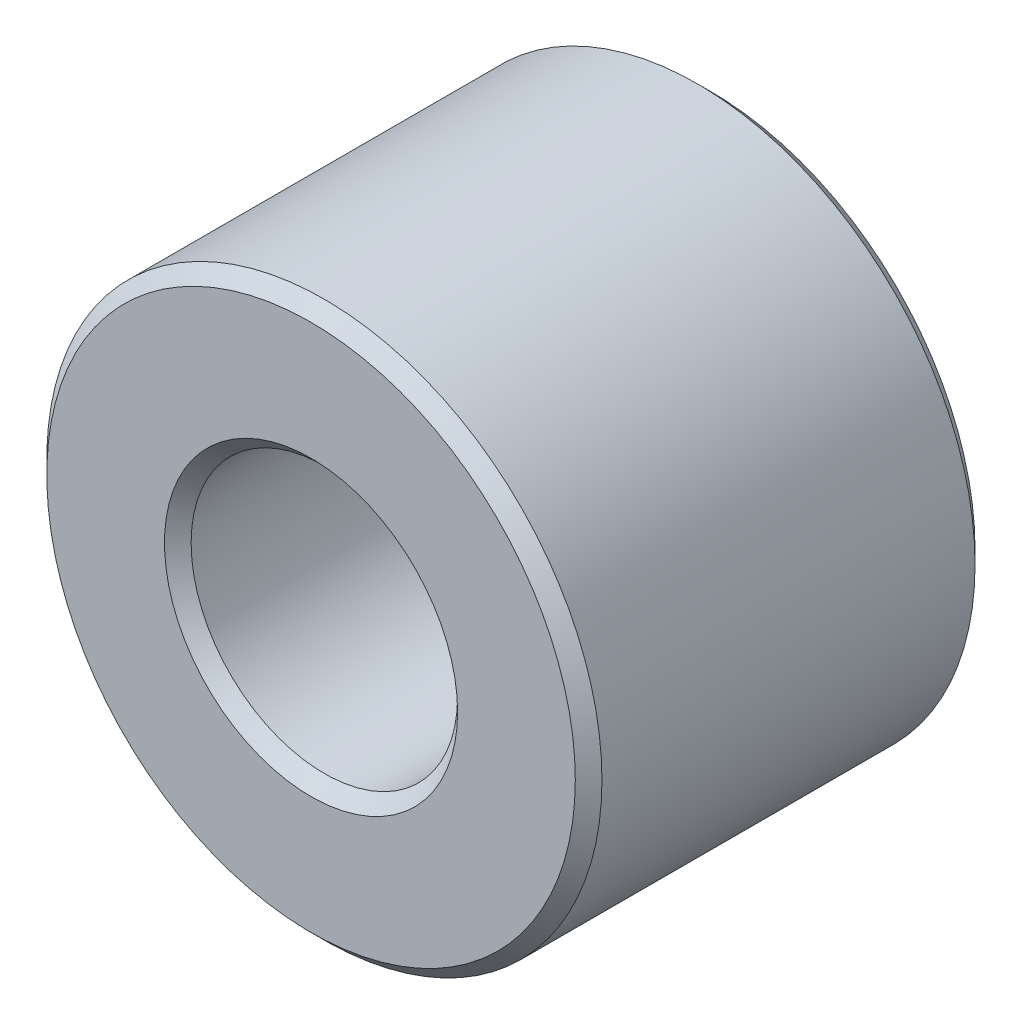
SolidWorks part; units mm, degrees
ref_plane "Front Plane" through (0, 0, 0) normal (0, 0, 1) x (1, 0, 0)
ref_plane "Top Plane" through (0, 0, 0) normal (0, 1, 0) x (1, 0, 0)
ref_plane "Right Plane" through (0, 0, 0) normal (1, 0, 0) x (0, 0, -1)
sketch "Sketch1" plane through (0, 0, 0) normal (0, 0, 1) x (1, 0, 0)
  circle A0 centre (0, 0) radius 12
  circle A1 centre (0, 0) radius 25
  dimension "D1" = 24
  dimension "D2" = 50
extrude "Boss-Extrude1" add sketch "Sketch1" along normal mid plane 36
chamfer "Chamfer1" distance 1.2 angle 45 4 edges at (12, 0, -18) (25, 0, -18) (12, 0, 18) (25, 0, 18)
